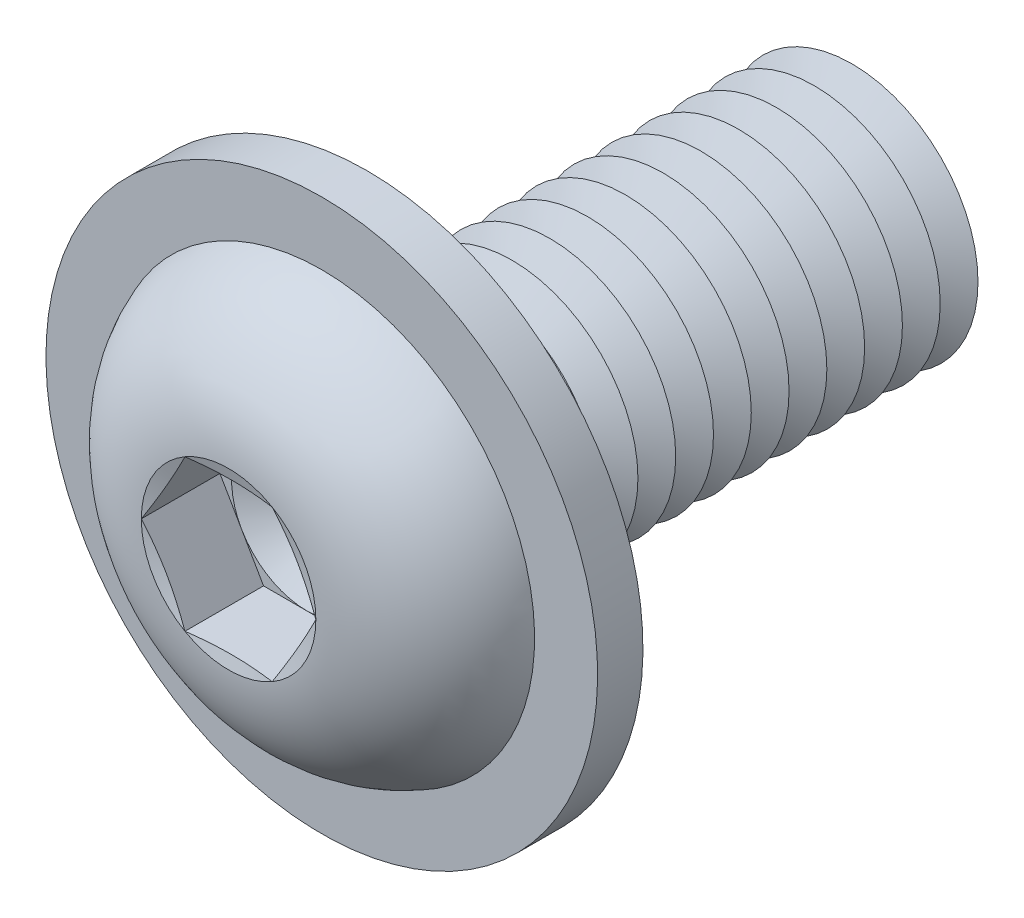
SolidWorks part; units mm, degrees
ref_plane "Front Plane" through (0, 0, 0) normal (0, 0, 1) x (1, 0, 0)
ref_plane "Top Plane" through (0, 0, 0) normal (0, 1, 0) x (1, 0, 0)
ref_plane "Right Plane" through (0, 0, 0) normal (1, 0, 0) x (0, 0, -1)
sketch "Sketch1" plane through (0, 0, 0) normal (1, 0, 0) x (0, 0, -1)
  line L0 (0, 5) -> (0, 8.75)
  line L3 (0, 5) -> (20, 5)
  line L4 (20, 5) -> (20, 0)
  line L5 (20, 0) -> (-5.5, 0) construction
  line L6 (-5.5, 0) -> (20, 0)
  line L7 (-5.5, 3.4641) -> (-5.5, 1.732) construction
  line L8 (-5.5, 1.732) -> (-5.5, 0)
  line L9 (-5.5, 3.4641) -> (-5.0359, 1.732)
  line L10 (-5.0359, 1.732) -> (-5.5, 1.732)
  line L11 (20, 0) -> (22.7481, 0) construction
  line L12 (0, 8.75) -> (-5.5, 8.75) construction
  arc A1 (0, 8.75) -> (-5.5, 3.4641) centre (0, 3.2457) ccw
  point P8 (20, 2.5)
  dimension "D1" = 17.5
  dimension "D2" = 10
  dimension "D3" = 5.5
  dimension "D4" = 6.9282
  dimension "D5" = 20
  dimension "D6" = 15
revolve "Revolve1" add sketch "Sketch1" angle 360 about L5
fillet "Fillet1" radius 0.75 1 edges at (-5, 0, 0)
sketch "Sketch2" plane through (0, 0, 0) normal (1, 0, 0) x (0, 0, -1)
  line L0 (19.25, 5) -> (20.75, 5)
  line L1 (20, 5) -> (0.75, 5) construction
  line L2 (20.75, 5) -> (20, 3.701)
  line L3 (20, -5) -> (20, 5) construction
  line L4 (20, 3.701) -> (19.25, 5)
  dimension "D1" = 1.5
revolve "Cut-Revolve1" cut sketch "Sketch2" angle 360 about axis through (0, 0, -20) along (0, 0, -1)
pattern_linear "LPattern1" count 13 spacing 1.5 along (0, 0, 1) of "Cut-Revolve1"
sketch "Sketch3" plane through (0, 0, 5.5) normal (0, 0, 1) x (1, 0, 0)
  line L7 (1.732, 3) -> (-1.7321, 3)
  line L8 (-1.7321, 3) -> (-3.4641, 0)
  line L9 (-3.4641, 0) -> (-1.732, -3)
  line L10 (-1.732, -3) -> (1.732, -3)
  line L11 (1.732, -3) -> (3.4641, 0)
  line L12 (3.4641, 0) -> (1.732, 3)
  circle A0 centre (0, 0) radius 3 construction
  circle A3 centre (0, 0) radius 3.4641 construction
extrude "Cut-Extrude1" cut sketch "Sketch3" against normal blind 3.12
sketch "Sketch4" plane through (0, 0, 2.38) normal (0, 0, 1) x (1, 0, 0)
  line L1 (1.732, 3) -> (-1.7321, 3) construction
  circle A0 centre (0, 0) radius 3
extrude "Cut-Extrude2" cut sketch "Sketch4" against normal through all draft 60
sketch "Sketch5" plane through (0, 0, 0) normal (0, 0, -1) x (-1, 0, 0)
  circle A0 centre (0, 0) radius 10.95
  circle A1 centre (0, 0) radius 5.75
  circle A2 centre (0, 0) radius 5.75 construction
  dimension "D1" = 21.9
extrude "Boss-Extrude1" add sketch "Sketch5" against normal blind 1.8
